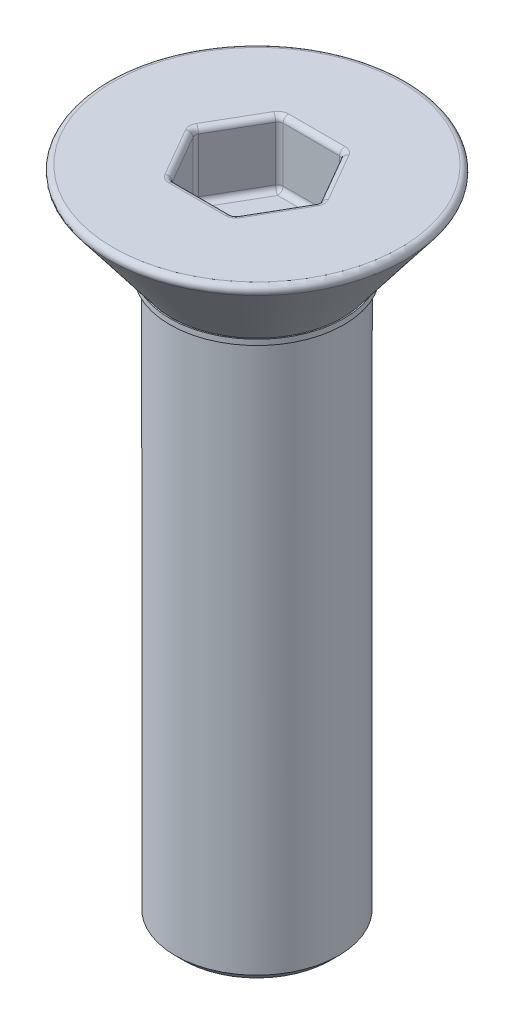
SolidWorks part; units mm, degrees
ref_plane "前视基准面" through (0, 0, 0) normal (0, 0, 1) x (1, 0, 0)
ref_plane "上视基准面" through (0, 0, 0) normal (0, 1, 0) x (1, 0, 0)
ref_plane "右视基准面" through (0, 0, 0) normal (1, 0, 0) x (0, 0, -1)
sketch "Sketch1" plane through (0, 0, 0) normal (1, 0, 0) x (0, 0, -1)
  line L0 (0, 1.75) -> (0, -10.25) construction
  line L1 (2.845, 1.75) -> (-2.845, 1.75) construction
  line L2 (-2.845, 1.75) -> (-1.5, 0)
  line L3 (-1.5, 0) -> (-1.5, -10.25)
  line L4 (-1.5, -10.25) -> (1.5, -10.25) construction
  line L5 (1.5, 0) -> (1.5, -10.25) construction
  line L6 (2.845, 1.75) -> (1.5, 0) construction
  line L7 (-2.845, 1.75) -> (0, 1.75)
  line L8 (0, 1.75) -> (0, -10.25)
  line L9 (0, -10.25) -> (-1.5, -10.25)
  dimension "公称直径" = 3
  dimension "螺丝长度" = 12
  dimension "头部厚度" = 1.75
  dimension "头部直径" = 5.69
revolve "Revolve1" add sketch "Sketch1" angle 360 about L8
sketch "Sketch2" plane through (0, 1.75, 0) normal (0, 1, 0) x (1, 0, 0)
  line L1 (1.1547, 0) -> (0.5774, 1)
  line L2 (0.5774, 1) -> (-0.5774, 1)
  line L3 (-0.5774, 1) -> (-1.1547, 0)
  line L4 (-1.1547, 0) -> (-0.5774, -1)
  line L5 (-0.5774, -1) -> (0.5774, -1)
  line L6 (0.5774, -1) -> (1.1547, 0)
  circle A0 centre (0, 0) radius 1 construction
  dimension "六角对边" = 2
extrude "Cut-Extrude1" cut sketch "Sketch2" against normal blind 1.2
chamfer "Chamfer1" distance 0.15 angle 45 1 edges at (0, -10.25, 1.5)
fillet "Fillet1" radius 0.1 19 edges at (-0.866, 0.55, 0.5) (-0.866, 1.75, 0.5) (-0.5774, 1.15, 1) (0, 0.55, 1) (0, 1.75, 1) (0.5774, 1.15, 1) (0.866, 0.55, 0.5) (0.866, 1.75, 0.5) (1.1547, 1.15, 0) (0.866, 0.55, -0.5) (0.866, 1.75, -0.5) (-0.866, 0.55, -0.5) (-1.1547, 1.15, 0) (-0.866, 1.75, -0.5) (0.5774, 1.15, -1) (0, 0.55, -1) (-0.5774, 1.15, -1) (0, 1.75, -1) (0, 1.75, 2.845)
ref_plane "基准面1" through (0, 0, 0) normal (0, 1, 0) x (1, 0, 0)
sketch "草图1" plane through (0, 0, 0) normal (0, 1, 0) x (1, 0, 0)
  circle A0 centre (0, 0) radius 1.6
  circle A1 centre (0, 0) radius 1.5 construction
  dimension "D1" = 0.1
extrude "参考配合凸台" add sketch "草图1" along normal blind 0.1 separate body
